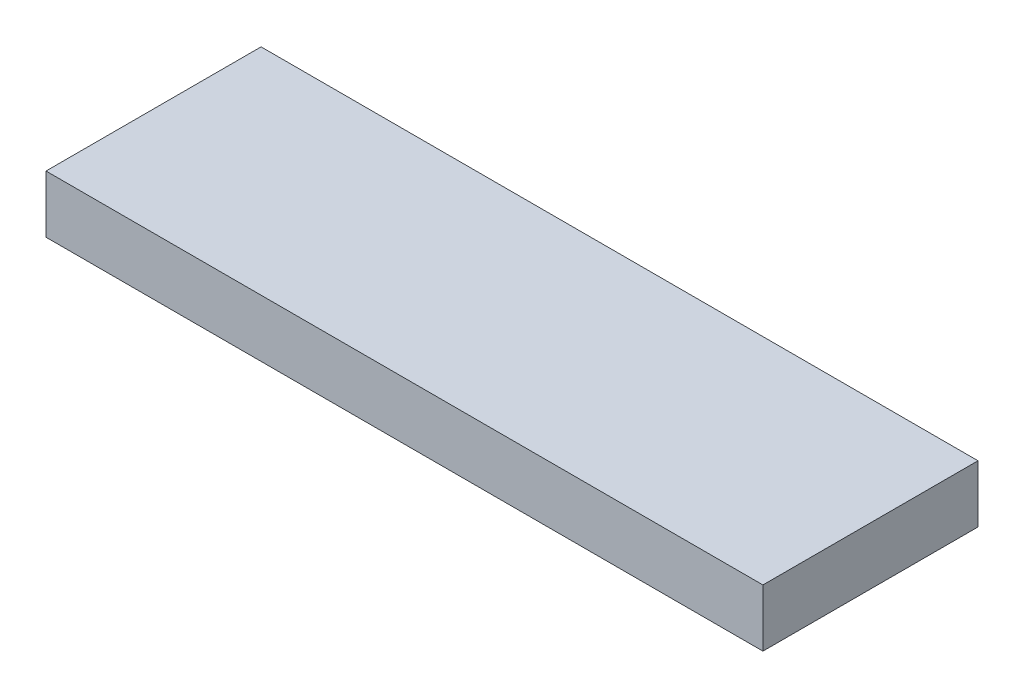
SolidWorks part; units mm, degrees
ref_plane "Front Plane" through (0, 0, 0) normal (0, 0, 1) x (1, 0, 0)
ref_plane "Top Plane" through (0, 0, 0) normal (0, 1, 0) x (1, 0, 0)
ref_plane "Right Plane" through (0, 0, 0) normal (1, 0, 0) x (0, 0, -1)
sketch "Sketch1" plane through (0, 0, 0) normal (0, 1, 0) x (1, 0, 0)
  line L1 (-50, -15) -> (50, -15)
  line L2 (-50, -15) -> (-50, 15)
  line L3 (-50, 15) -> (50, 15)
  line L4 (50, -15) -> (50, 15)
  line L5 (-50, -15) -> (50, 15) construction
  line L6 (-50, 15) -> (50, -15) construction
  point P0 (0, 0)
  dimension "D1" = 30
  dimension "D2" = 100
extrude "Boss-Extrude1" add sketch "Sketch1" along normal mid plane 8
